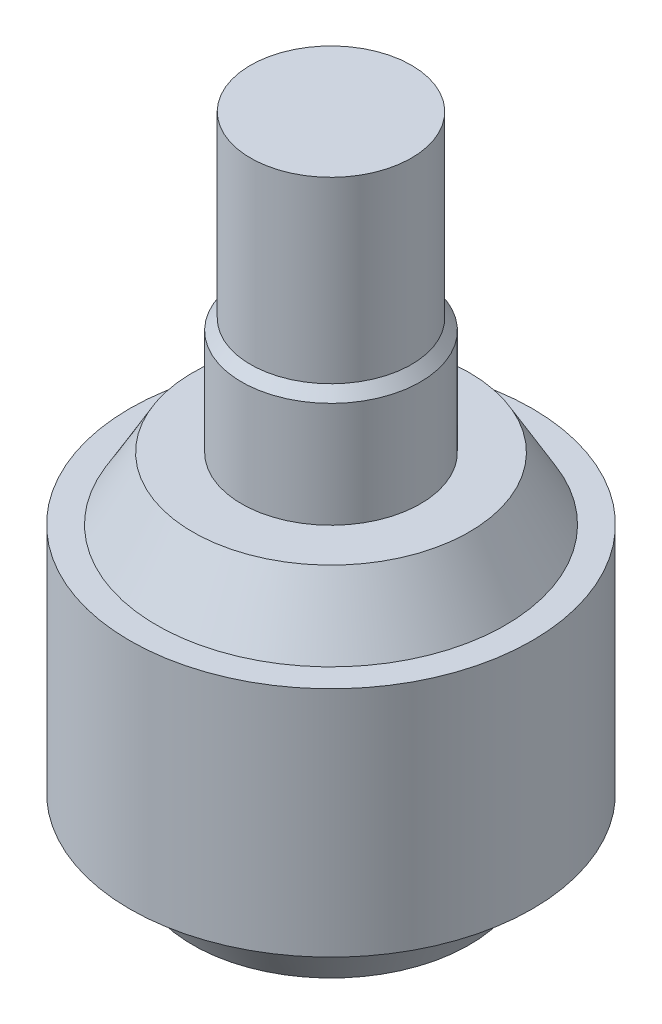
SolidWorks part; units mm, degrees
ref_plane "Front" through (0, 0, 0) normal (0, 0, 1) x (1, 0, 0)
ref_plane "Top" through (0, 0, 0) normal (0, 1, 0) x (1, 0, 0)
ref_plane "Right" through (0, 0, 0) normal (1, 0, 0) x (0, 0, -1)
sketch "Sketch1" plane through (0, 0, 0) normal (0, 0, 1) x (1, 0, 0)
  line L0 (0, 0) -> (0, 30.3621) construction
  line L1 (0, 0) -> (1.5459, 0)
  line L2 (1.5459, 0) -> (1.95, 0.7)
  line L3 (1.95, 0.7) -> (2.25, 0.7)
  line L4 (2.25, 0.7) -> (2.25, 3.3)
  line L5 (2.25, 3.3) -> (1.95, 3.3)
  line L6 (1.95, 3.3) -> (1.5459, 4)
  line L7 (1.5459, 4) -> (1, 4)
  line L8 (1, 4) -> (1, 5.1808)
  line L9 (1, 5.1808) -> (0.9, 5.3)
  line L10 (0.9, 5.3) -> (0.9, 7.3)
  line L11 (0.9, 7.3) -> (0, 7.3)
  line L12 (0, 7.3) -> (0, 0)
  dimension "D1" = 120
  dimension "D2" = 120
  dimension "D3" = 140
  dimension "D4" = 0.7
  dimension "D5" = 0.7
  dimension "D6" = 4.5
  dimension "D7" = 4
  dimension "D8" = 4
  dimension "D9" = 2
  dimension "D10" = 2
  dimension "D11" = 0.1
  dimension "D12" = 0.3
revolve "Revolve1" add sketch "Sketch1" angle 360 about L0
